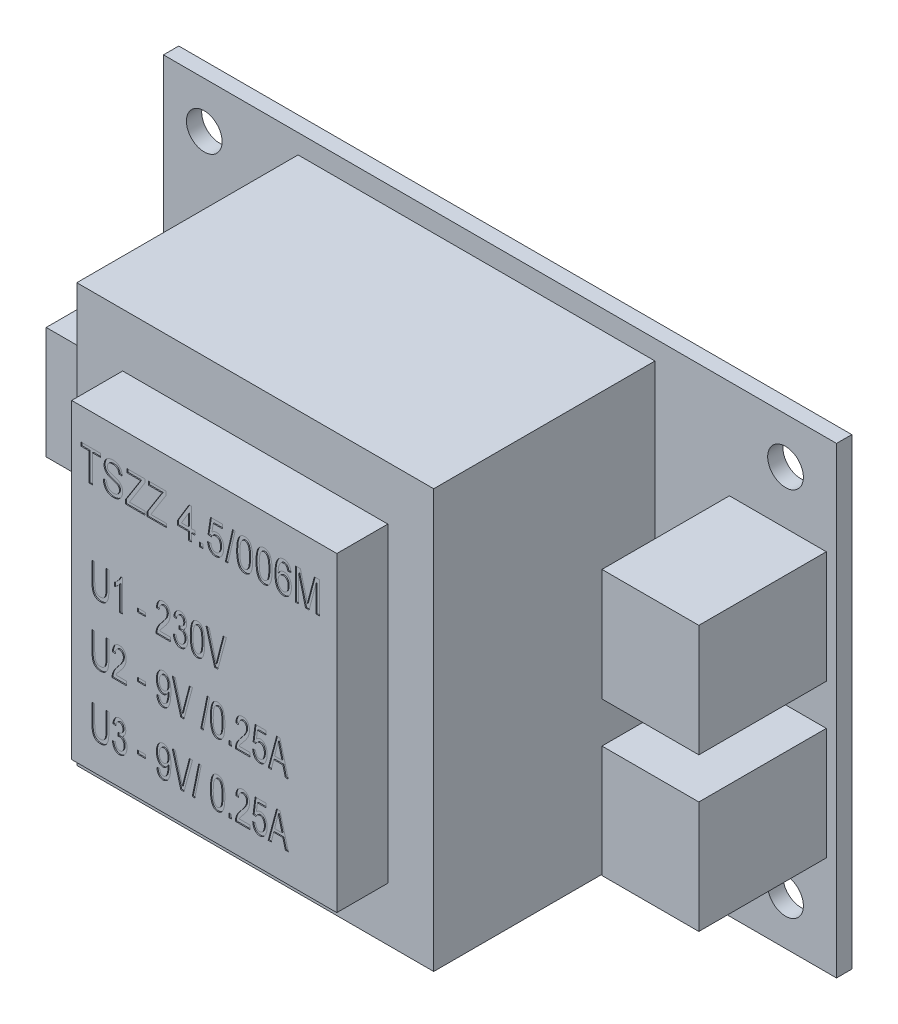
SolidWorks part; units mm, degrees
ref_plane "Přední rovina" through (0, 0, 0) normal (0, 0, 1) x (1, 0, 0)
ref_plane "Horní rovina" through (0, 0, 0) normal (0, 1, 0) x (1, 0, 0)
ref_plane "Pravá rovina" through (0, 0, 0) normal (1, 0, 0) x (0, 0, -1)
sketch "Skica1" plane through (0, 0, 0) normal (0, 0, 1) x (1, 0, 0)
  line L1 (-44.2121, 9.4167) -> (21.7879, 9.4167)
  line L2 (-44.2121, 9.4167) -> (-44.2121, -35.9833)
  line L3 (-44.2121, -35.9833) -> (21.7879, -35.9833)
  line L4 (21.7879, 9.4167) -> (21.7879, -35.9833)
  circle A0 centre (-40.2121, 4.9167) radius 1.75
  circle A1 centre (16.7879, 4.9167) radius 1.75
  circle A2 centre (16.7879, -31.4833) radius 1.75
  circle A3 centre (-40.2121, -31.4833) radius 1.75
  dimension "D3" = 3.5
  dimension "D1" = 45.4
  dimension "D2" = 66
  dimension "D4" = 4
  dimension "D5" = 4
  dimension "D6" = 5
  dimension "D7" = 5
  dimension "D8" = 4.5
  dimension "D9" = 4.5
  dimension "D10" = 4.5
  dimension "D11" = 4.5
extrude "Přidat vysunutím1" add sketch "Skica1" along normal blind 1.5
sketch "Skica2" plane through (0, 0, 0) normal (0, 0, 1) x (1, 0, 0)
  line L0 (-44.2121, -35.9833) -> (21.7879, -35.9833) construction
  line L1 (-31.0121, 7.5167) -> (3.9879, 7.5167)
  line L2 (-31.0121, 7.5167) -> (-31.0121, -33.4833)
  line L3 (-31.0121, -33.4833) -> (3.9879, -33.4833)
  line L4 (3.9879, 7.5167) -> (3.9879, -33.4833)
  line L5 (-44.2121, 9.4167) -> (-44.2121, -35.9833) construction
  dimension "D1" = 35
  dimension "D2" = 41
  dimension "D3" = 2.5
  dimension "D4" = 13.2
extrude "Přidat vysunutím2" add sketch "Skica2" along normal blind 23.2
sketch "Skica3" plane through (0, 0, 23.2) normal (0, 0, 1) x (1, 0, 0)
  line L1 (-26.5121, 2.2667) -> (-0.5121, 2.2667)
  line L2 (-26.5121, 2.2667) -> (-26.5121, -28.2333)
  line L3 (-26.5121, -28.2333) -> (-0.5121, -28.2333)
  line L4 (-0.5121, 2.2667) -> (-0.5121, -28.2333)
  line L6 (-31.0121, 7.5167) -> (3.9879, -33.4833) construction
  line L9 (3.9879, 7.5167) -> (-31.0121, -33.4833) construction
  line L10 (-26.5121, 2.2667) -> (-0.5121, -28.2333) construction
  line L11 (-0.5121, 2.2667) -> (-26.5121, -28.2333) construction
  point P4 (-13.5121, -12.9833)
  point P5 (-13.5121, -12.9833)
  dimension "D1" = 26
  dimension "D2" = 30.5
extrude "Přidat vysunutím3" add sketch "Skica3" along normal blind 5
sketch "Skica4" plane through (0, 0, 28.2) normal (0, 0, 1) x (1, 0, 0)
  text T0 "TSZZ 4.5/006M" font "Arial" height in points 12
  text T1 "U1 - 230V" font "Arial" height in points 12
  text T2 "U2 - 9V /0.25A" font "Arial" height in points 12
  text T3 "U3 - 9V/ 0.25A" font "Arial" height in points 12
extrude "Odebrat vysunutím1" cut sketch "Skica4" against normal blind 0.1
sketch "Skica5" plane through (0, 0, 1.5) normal (0, 0, 1) x (1, 0, 0)
  line L0 (-44.2121, -35.9833) -> (21.7879, -35.9833) construction
  line L1 (-43.2121, -6.9833) -> (-33.7121, -6.9833)
  line L2 (-43.2121, -6.9833) -> (-43.2121, -17.9833)
  line L3 (-43.2121, -17.9833) -> (-33.7121, -17.9833)
  line L4 (-33.7121, -6.9833) -> (-33.7121, -17.9833)
  line L5 (11.2879, -0.2833) -> (20.7879, -0.2833)
  line L6 (11.2879, -0.2833) -> (11.2879, -11.2833)
  line L7 (11.2879, -11.2833) -> (20.7879, -11.2833)
  line L8 (20.7879, -0.2833) -> (20.7879, -11.2833)
  line L9 (11.2879, -15.2833) -> (20.7879, -15.2833)
  line L10 (11.2879, -15.2833) -> (11.2879, -26.2833)
  line L11 (11.2879, -26.2833) -> (20.7879, -26.2833)
  line L12 (20.7879, -15.2833) -> (20.7879, -26.2833)
  line L13 (21.7879, 9.4167) -> (-44.2121, 9.4167) construction
  line L14 (-44.2121, 9.4167) -> (-44.2121, -35.9833) construction
  line L15 (21.7879, -35.9833) -> (21.7879, 9.4167) construction
  dimension "D1" = 9.5
  dimension "D2" = 11
  dimension "D3" = 9.7
  dimension "D4" = 9.7
  dimension "D5" = 18
  dimension "D6" = 1
  dimension "D7" = 1
  dimension "D8" = 1
extrude "Přidat vysunutím4" add sketch "Skica5" along normal blind 12.5
